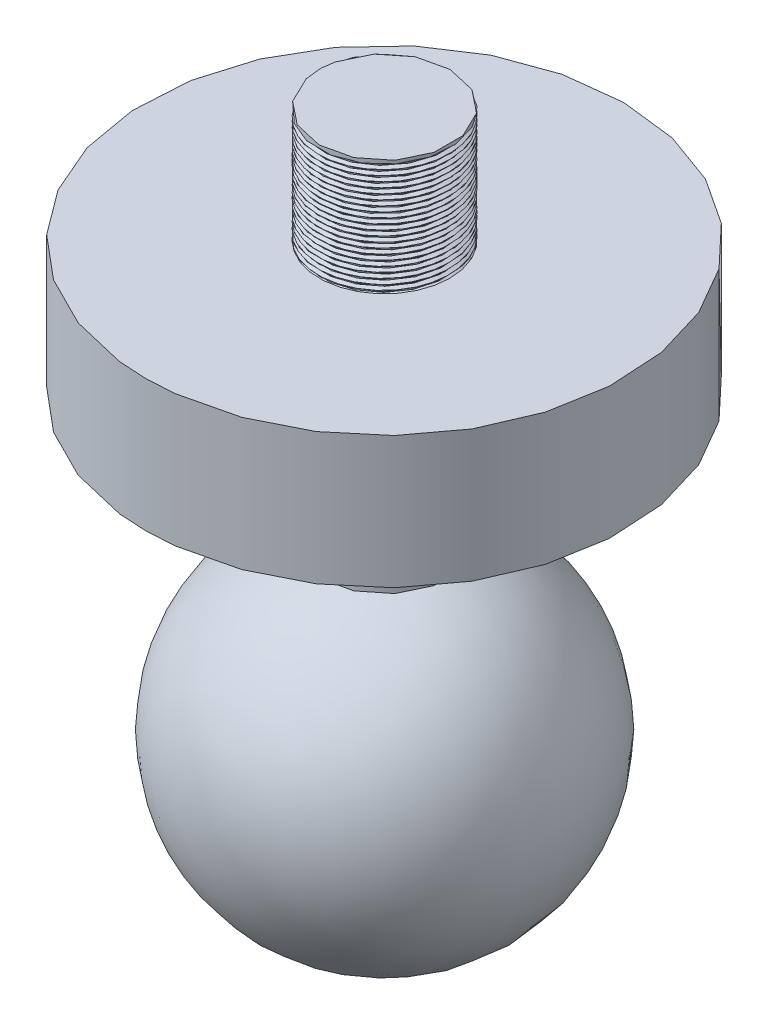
SolidWorks part; units mm, degrees
ref_plane "Front" through (0, 0, 0) normal (0, 0, 1) x (1, 0, 0)
ref_plane "Top" through (0, 0, 0) normal (0, 1, 0) x (1, 0, 0)
ref_plane "Right" through (0, 0, 0) normal (1, 0, 0) x (0, 0, -1)
sketch "Sketch1" plane through (0, 0, 0) normal (0, 1, 0) x (1, 0, 0)
  line L0 (0, 10.69) -> (0, -10.69)
  arc A0 (0, -10.69) -> (0, 10.69) centre (0, 0) ccw
  dimension "D1" = 10.69
revolve "Revolve1" add sketch "Sketch1" angle 360 about L0
ref_plane "Plane1" through (0, 10.69, 0) normal (0, 1, 0) x (1, 0, 0)
sketch "Sketch4" plane through (0, 10.69, 0) normal (0, 1, 0) x (1, 0, 0)
  circle A0 centre (0, 0) radius 1.4224
  point P0 (0, 0)
  dimension "D1" = 2.8448
extrude "Cut-Extrude1" cut sketch "Sketch4" against normal blind 4
sketch "Sketch6" plane through (0, 6.69, 0) normal (0, 1, 0) x (1, 0, 0)
  circle A0 centre (0, 0) radius 3.9688
  dimension "D1" = 7.9375
extrude "Boss-Extrude3" add sketch "Sketch6" along normal blind 26
ref_plane "Plane4" through (0, 17.69, 0) normal (0, 1, 0) x (1, 0, 0)
sketch "Sketch9" plane through (0, 17.69, 0) normal (0, 1, 0) x (1, 0, 0)
  circle A0 centre (0, 0) radius 14.5
extrude "Boss-Extrude4" add sketch "Sketch9" along normal blind 8 contours A0
thread "Thread2" pitch 0.3175 start angle 0, offset 0, length 0, pitch 0.3175, diameter 7.9375
ref_plane "Plane5" through (-3.9688, 32.69, 0) normal (0, 0, 1) x (-1, 0, 0)
sketch "Thread Profile2" plane through (-3.9688, 32.69, 0) normal (0, 0, 1) x (-1, 0, 0)
  line L0 (0, 0) -> (0, 0.3175) construction
  line L11 (0, 0) -> (0, 0.2778)
  line L12 (0, 0.2778) -> (-0.1719, 0.1786)
  line L13 (-0.1719, 0.1786) -> (-0.1719, 0.0992)
  line L15 (-0.1719, 0.0992) -> (0, 0)
  line L17 (-0.1719, 0.1389) -> (0, 0.1389) construction
  point P2 (0, 0)
  dimension "Pitch" = 0.3175
  dimension "Profile_Angle" = 60
  dimension "Profile_Land" = 0.0794
  dimension "Profile_Height" = 0.1719
